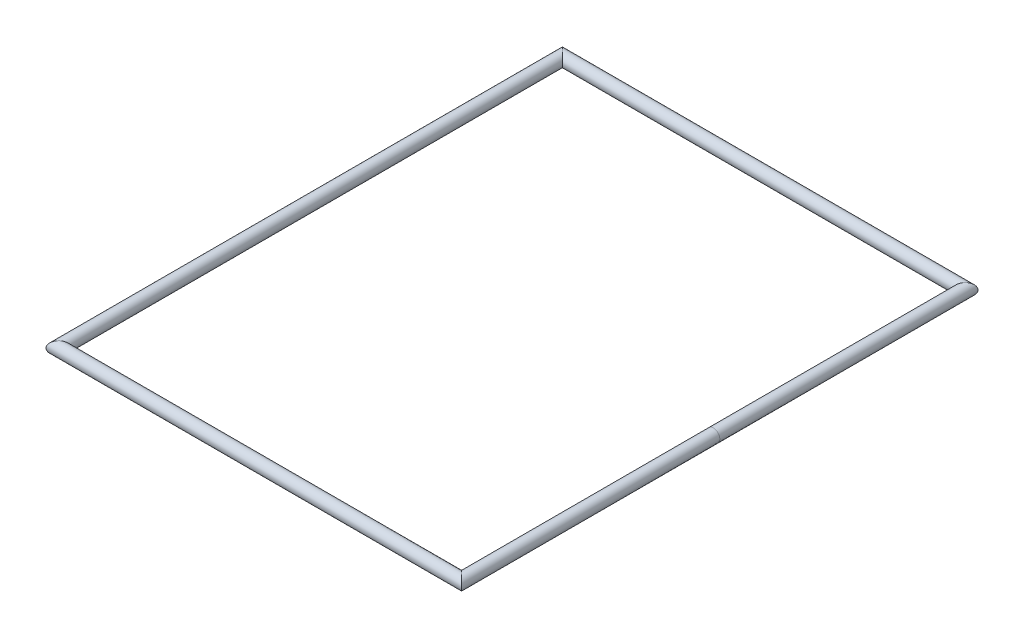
SolidWorks part; units mm, degrees
ref_plane "Front Plane" through (0, 0, 0) normal (0, 0, 1) x (1, 0, 0)
ref_plane "Top Plane" through (0, 0, 0) normal (0, 1, 0) x (1, 0, 0)
ref_plane "Right Plane" through (0, 0, 0) normal (1, 0, 0) x (0, 0, -1)
sketch "Sketch1" plane through (0, 0, 0) normal (0, 0, 1) x (1, 0, 0)
  circle A0 centre (0, 0) radius 17
  circle A2 centre (0, 0) radius 19
  point P1 (0, 0)
  dimension "D1" = 38
  dimension "D2" = 2
sketch "Sketch2" plane through (0, 0, 0) normal (0, 1, 0) x (1, 0, 0)
  line L1 (-1200, -750) -> (0, -750)
  line L2 (-1200, -750) -> (-1200, 750)
  line L3 (-1200, 750) -> (0, 750)
  line L4 (0, -750) -> (0, 750)
  line L5 (-1200, -750) -> (0, 750) construction
  line L6 (-1200, 750) -> (0, -750) construction
  point P0 (-600, 0)
  dimension "D1" = 1500
  dimension "D2" = 1200
sweep "Sweep1" add profiles "Sketch1" path "Sketch2"
